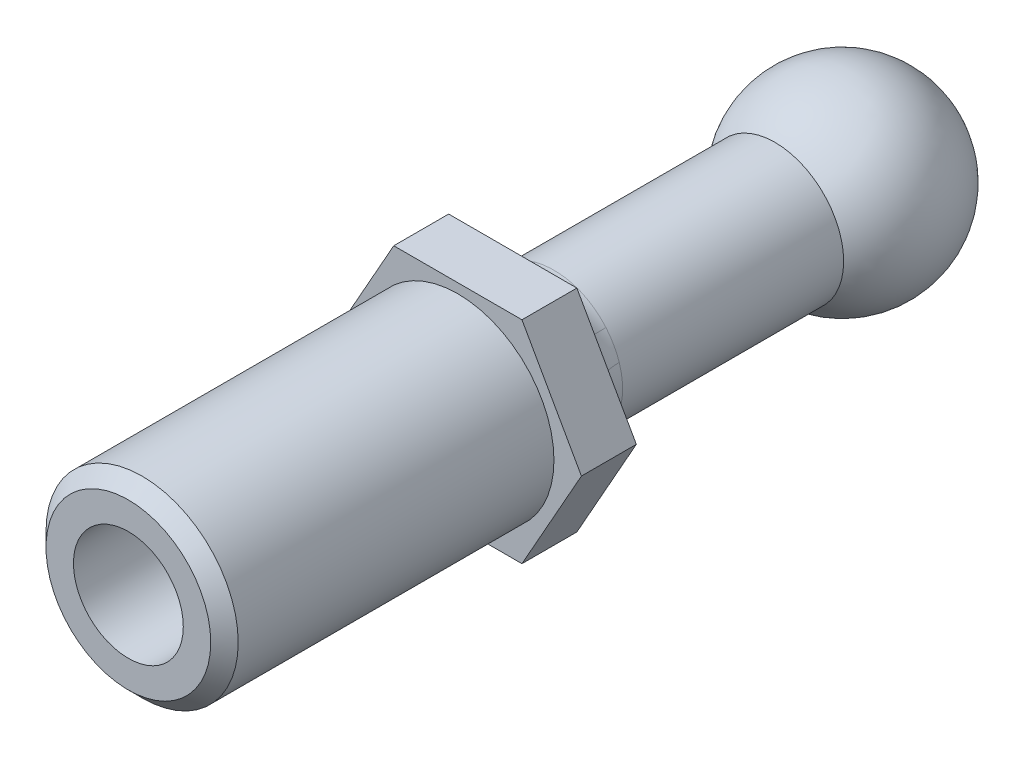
SolidWorks part; units mm, degrees
ref_plane "Plane1" through (0, 0, 0) normal (0, 0, 1) x (1, 0, 0)
ref_plane "Plane2" through (0, 0, 0) normal (0, 1, 0) x (1, 0, 0)
ref_plane "Plane3" through (0, 0, 0) normal (1, 0, 0) x (0, 0, -1)
sketch "Esquisse1" plane through (0, 0, 0) normal (0, 0, 1) x (1, 0, 0)
  line L0 (0, 3.5) -> (0, -3.5)
  line L3 (0, 10) -> (0, -20) construction
  arc A0 (0, 3.5) -> (0, -3.5) centre (0, 0) ccw
  dimension "D1" = 7
revolve "Base-Révolution" add sketch "Esquisse1" angle 360 about L3
sketch "Esquisse2" plane through (0, 0, 0) normal (0, 0, 1) x (1, 0, 0)
  circle A0 centre (0, 0) radius 2.5
  dimension "D1" = 5
extrude "Boss.-Extru.1" add sketch "Esquisse2" along normal blind 12
sketch "Esquisse4" plane through (0, 0, 12) normal (0, 0, 1) x (1, 0, 0)
  line L0 (4.5, 0) -> (2.3344, 3.8471)
  line L1 (2.3344, 3.8471) -> (-2.3344, 3.8471)
  line L2 (4.5, 0) -> (2.3344, -3.8471)
  line L3 (2.3344, -3.8471) -> (-2.3344, -3.8471)
  line L4 (-4.5, 0) -> (-2.3344, -3.8471)
  line L5 (-2.3344, 3.8471) -> (-4.5, 0)
extrude "Boss.-Extru.2" add sketch "Esquisse4" along normal blind 2
fillet "Congé2" radius 1.5
sketch "Esquisse5" plane through (0, 0, 14) normal (0, 0, 1) x (1, 0, 0)
  circle A0 centre (0, 0) radius 3.5
  dimension "D1" = 7
extrude "Boss.-Extru.3" add sketch "Esquisse5" along normal blind 12
sketch "Esquisse6" plane through (0, 0, 26) normal (0, 0, 1) x (1, 0, 0)
  circle A0 centre (0, 0) radius 2
  dimension "D1" = 4
extrude "Enlèv. mat.-Extru.1" cut sketch "Esquisse6" against normal blind 10
chamfer "Chanfrein2" distance 0.5 angle 45
